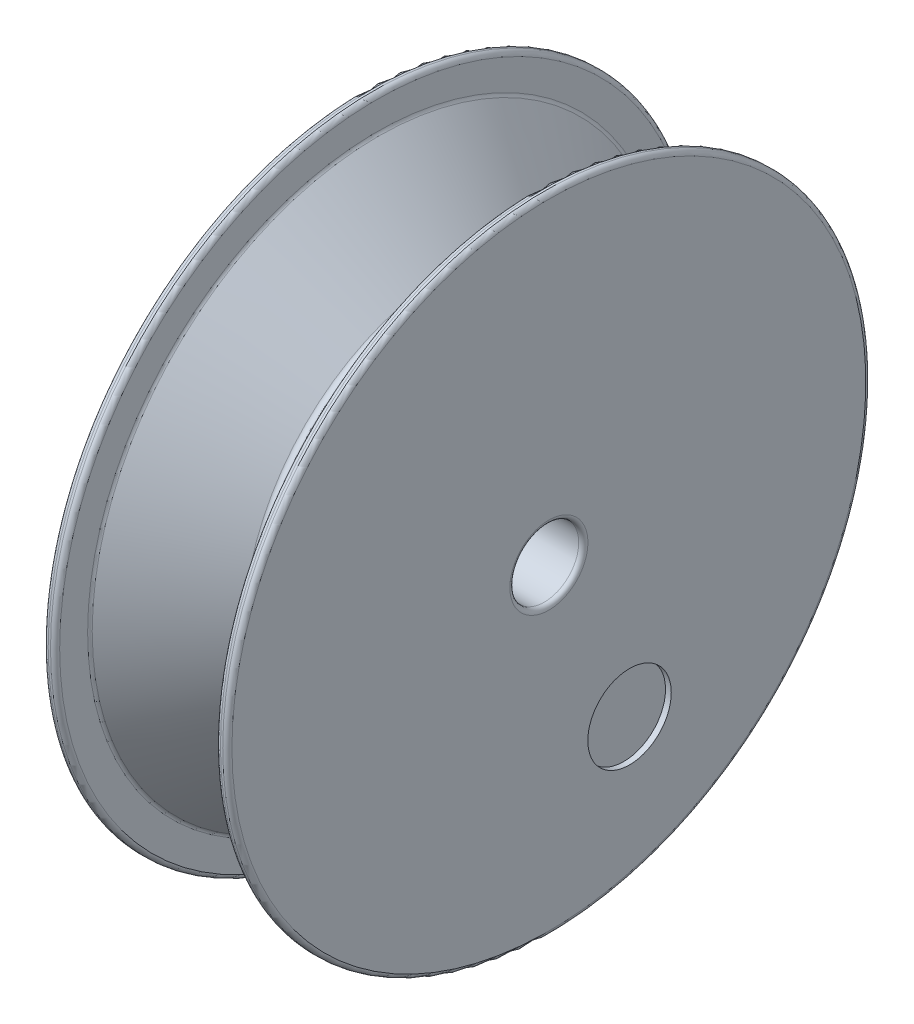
SolidWorks part; units mm, degrees
ref_plane "Face" through (0, 0, 0) normal (0, 0, 1) x (1, 0, 0)
ref_plane "Dessus" through (0, 0, 0) normal (0, 1, 0) x (1, 0, 0)
ref_plane "Droite" through (0, 0, 0) normal (1, 0, 0) x (0, 0, -1)
sketch "Esquisse1" plane through (0, 0, 0) normal (0, 0, 1) x (1, 0, 0)
  line L1 (-3.5, 12.5) -> (0, 9)
  line L2 (-0.5, 9.5) -> (0.5, 9.5) construction
  line L3 (4, 1.5) -> (4, 14)
  line L4 (-4, 14) -> (-3.5, 14)
  line L5 (-4, 1.5) -> (-4, 14)
  line L6 (0, 9) -> (3.5, 12.5)
  line L7 (-3.5, 14) -> (-3.5, 12.5)
  line L8 (3.5, 12.5) -> (3.5, 14)
  line L9 (4, 14) -> (3.5, 14)
  line L10 (-4, 1.5) -> (4, 1.5)
  line L11 (-3, 12) -> (3, 12) construction
  line L12 (0, 0) -> (68.6205, 0) construction
  line L13 (-3, 12) -> (-0.5, 9.5) construction
  line L14 (0.5, 9.5) -> (3, 12) construction
  dimension "D8" = 3.5
  dimension "D1" = 4
  dimension "D2" = 8
  dimension "D3" = 1.5
  dimension "D4" = 0.5
  dimension "D5" = 0.5
  dimension "D6" = 1.5
  dimension "D7" = 45
  dimension "D9" = 45
  dimension "D10" = 12.5
  dimension "D11" = 9.5
  dimension "D12" = 6
  dimension "D13" = 3
  dimension "D14" = 2.5
  dimension "D15" = 1
  dimension "D16" = 0.5
revolve "Révolution2" add sketch "Esquisse1" angle 360 about L12
fillet "Congé1" radius 0.2 9 edges at (3.5, 0, 14) (3.5, 0, 12.5) (0, 0, 9) (-3.5, 0, 12.5) (-3.5, 0, 14) (4, 0, 1.5) (4, 0, 14) (-4, 0, 14) (-4, 0, 1.5)
sketch "Esquisse2" plane through (4, 0, 0) normal (1, 0, 0) x (0, 0, -1)
  circle A0 centre (3.5119, -7.4726) radius 1.8173
extrude "Enlèv. mat.-Extru.1" cut sketch "Esquisse2" against normal blind 0.25
